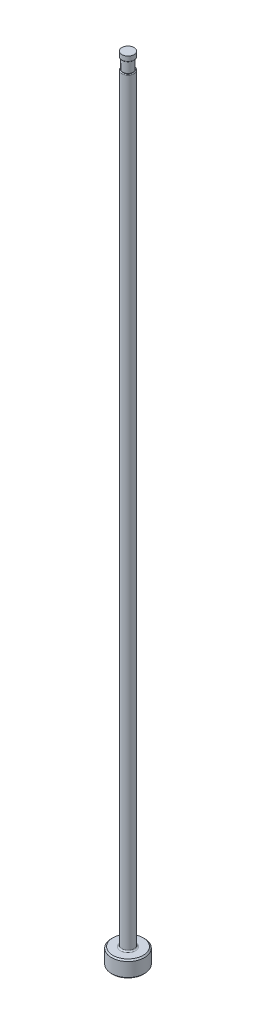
SolidWorks part; units mm, degrees
ref_plane "Front Plane" through (0, 0, 0) normal (0, 0, 1) x (1, 0, 0)
ref_plane "Top Plane" through (0, 0, 0) normal (0, 1, 0) x (1, 0, 0)
ref_plane "Right Plane" through (0, 0, 0) normal (1, 0, 0) x (0, 0, -1)
other "Configuration Table"
sketch "Sketch1" plane through (0, 0, 0) normal (0, 0, 1) x (1, 0, 0)
  line L0 (0, 259.9588) -> (0, -15.1925) construction
  line L1 (0, 0) -> (-3.175, 0)
  line L2 (-3.175, 0) -> (-3.175, 3.175)
  line L3 (-3.175, 3.175) -> (-1.19, 3.175)
  line L4 (-1.19, 3.175) -> (-1.19, 152.4)
  line L5 (-1.19, 152.4) -> (0, 152.4)
  line L6 (0, 152.4) -> (0, 0)
  dimension "L" = 152.4
  dimension "H" = 6.35
  dimension "T" = 3.175
  dimension "D" = 2.38
revolve "Revolve1" add sketch "Sketch1" angle 360 about L0
chamfer "Chamfer1" distance 0.254 angle 45 2 edges at (0, 3.175, 3.175) (0, 0, 3.175)
fillet "Fillet1" radius 0.254 1 edges at (0, 3.175, 1.19)
sketch "Sketch2" plane through (0, 0, 0) normal (0, 0, 1) x (1, 0, 0)
  line L0 (-1.19, 152.4) -> (-1.19, 3.429) construction
  line L1 (-1.19, 151.384) -> (-0.9868, 151.384)
  line L2 (-1.19, 151.384) -> (-1.19, 149.352)
  line L3 (-1.19, 149.352) -> (-0.9868, 149.352)
  line L4 (-0.9868, 151.384) -> (-0.9868, 149.352)
  line L5 (1.19, 152.4) -> (-1.19, 152.4) construction
  line L6 (0, 153.4483) -> (0, 147.3282) construction
  dimension "D1" = 2.032
  dimension "N" = 1.016
  dimension "FD" = 0.2032
  dimension "D3" = 1.9736
revolve "Vent Relief" cut sketch "Sketch2" angle 360 about L6
sketch "Sketch3" plane through (0, 0, 0) normal (0, 0, 1) x (1, 0, 0)
  line L0 (-0.9868, 150.368) -> (-0.9868, 86.868)
  line L1 (-0.9868, 151.384) -> (-0.9868, 149.352) construction
  line L2 (-1.19, 149.352) -> (-1.19, 3.429) construction
  line L3 (-1.19, 85.7504) -> (-1.19, 150.368)
  line L4 (-1.19, 150.368) -> (-0.9868, 150.368)
  arc A0 (-0.9868, 86.868) -> (-1.19, 85.7504) centre (-4.1618, 86.868) cw
  dimension "D1" = 3.175
  dimension "D2" = 63.5
extrude "D-Slot" cut sketch "Sketch3" against normal through all both and the other way through all
sketch "Sketch5" plane through (0, 0, 0) normal (0, 0, 1) x (1, 0, 0)
  line L0 (-1.19, 151.384) -> (1.19, 151.384) construction
  line L1 (-1.19, 152.4) -> (-1.1849, 152.4)
  line L2 (-1.19, 152.4) -> (-1.19, 151.384)
  line L3 (-1.19, 151.384) -> (-1.1849, 151.384)
  line L4 (-1.1849, 152.4) -> (-1.1849, 151.384)
  line L5 (0, 152.6877) -> (0, 150.5771) construction
  dimension "VP" = 0.0051
revolve "Vent Diameter" cut sketch "Sketch5" angle 360 about L5
fillet "Fillet2" radius 0.127 2 edges at (1.19, 149.352, 0) (0, 151.384, 1.1849)
sketch "Pocket Sketch" plane through (0, 0, 0) normal (0, 0, 1) x (1, 0, 0)
  line L0 (-3.5719, 0) -> (-3.5719, 3.2004)
  line L1 (-3.5719, 3.2004) -> (-2.1504, 3.2004)
  line L2 (-1.3884, 3.9624) -> (-1.3884, 22.225)
  line L3 (-1.3884, 22.225) -> (0, 22.225)
  line L4 (0, 22.225) -> (0, 0)
  line L5 (0, 0) -> (-3.5719, 0)
  line L6 (0, 12.6104) -> (0, -2.4989) construction
  line L7 (-3.175, 2.921) -> (-3.175, 0.254) construction
  line L8 (2.921, 3.175) -> (-2.921, 3.175) construction
  line L9 (-1.19, 85.7504) -> (-1.19, 3.429) construction
  line L10 (-2.1504, 3.2004) -> (-1.3884, 3.9624)
  point P3 (-1.3884, 3.2004)
  dimension "D1" = 7.1437
  dimension "D2" = 0.3969
  dimension "D3" = 0.0254
  dimension "D4" = 0.1984
  dimension "D5" = 2.7769
  dimension "D6" = 22.225
